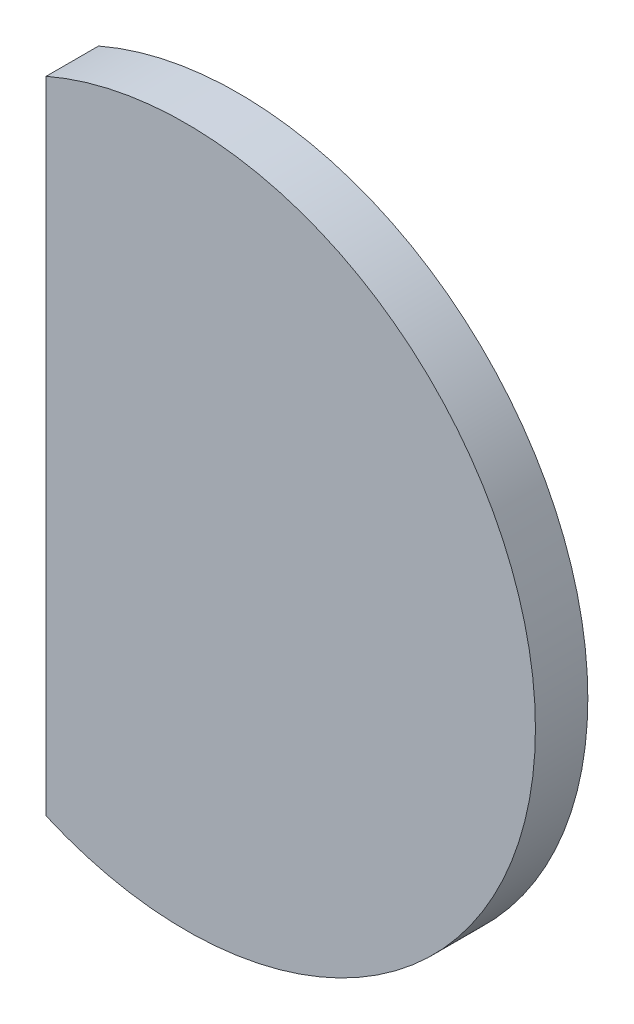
SolidWorks part; units mm, degrees
ref_plane "Płaszczyzna przednia" through (0, 0, 0) normal (0, 0, 1) x (1, 0, 0)
ref_plane "Płaszczyzna górna" through (0, 0, 0) normal (0, 1, 0) x (1, 0, 0)
ref_plane "Płaszczyzna prawa" through (0, 0, 0) normal (1, 0, 0) x (0, 0, -1)
sketch "Szkic1" plane through (0, 0, 0) normal (0, 0, 1) x (1, 0, 0)
  line L0 (-40, 91.6515) -> (-40, -91.6515)
  arc A0 (-40, -91.6515) -> (-40, 91.6515) centre (0, 0) ccw
  dimension "D1" = 100
  dimension "D2" = 40
extrude "Dodanie-wyciągnięcie1" add sketch "Szkic1" along normal blind 15
